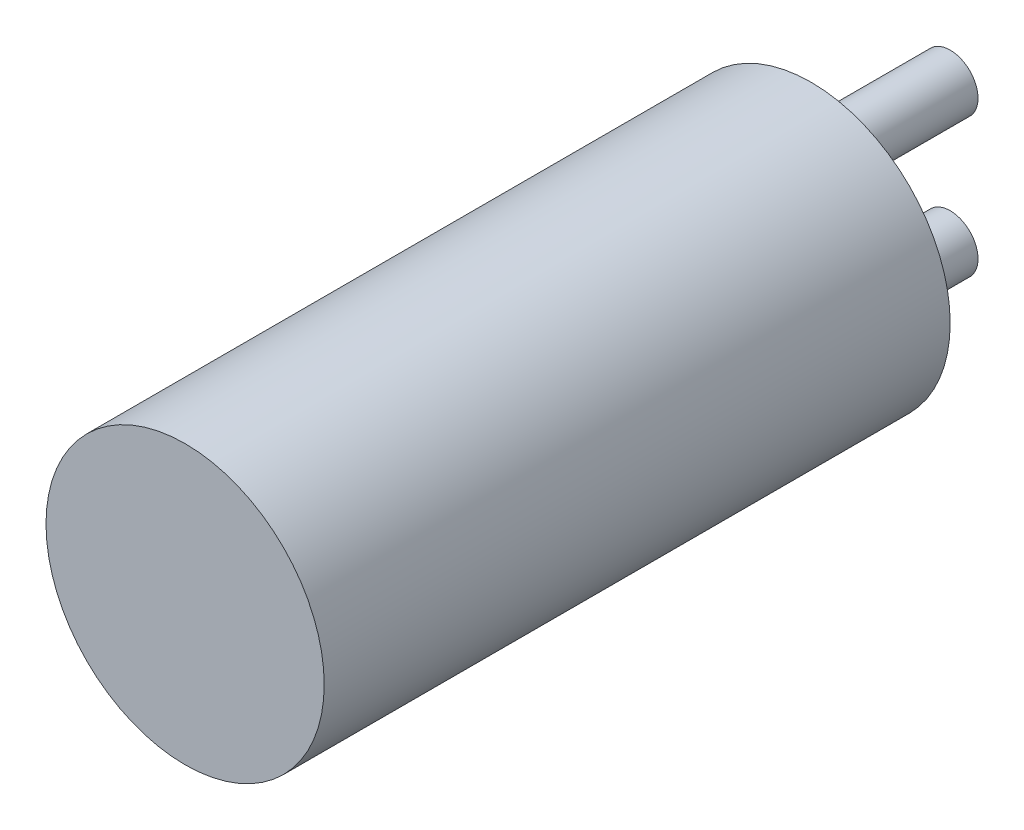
SolidWorks part; units mm, degrees
ref_plane "Спереди" through (0, 0, 0) normal (0, 0, 1) x (1, 0, 0)
ref_plane "Сверху" through (0, 0, 0) normal (0, 1, 0) x (1, 0, 0)
ref_plane "Справа" through (0, 0, 0) normal (1, 0, 0) x (0, 0, -1)
sketch "Эскиз1" plane through (0, 0, 0) normal (0, 0, 1) x (1, 0, 0)
  circle A0 centre (0, 0) radius 2.54
extrude "Бобышка-Вытянуть1" add sketch "Эскиз1" along normal blind 11.43
sketch "Эскиз2" plane through (0, 0, 0) normal (0, 0, -1) x (-1, 0, 0)
  circle A0 centre (0, 1.27) radius 0.508
  circle A1 centre (0, -1.27) radius 0.508
extrude "Бобышка-Вытянуть2" add sketch "Эскиз2" along normal blind 2.54
